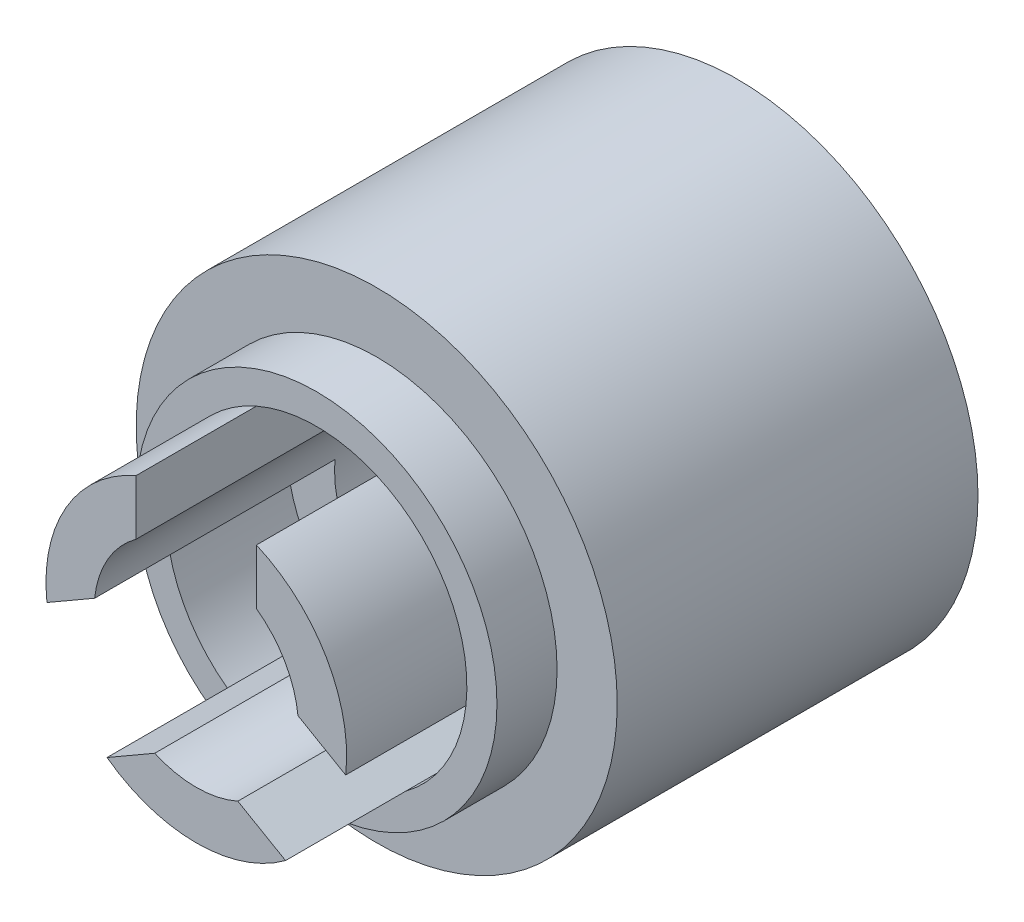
SolidWorks part; units mm, degrees
ref_plane "Front Plane" through (0, 0, 0) normal (0, 0, 1) x (1, 0, 0)
ref_plane "Top Plane" through (0, 0, 0) normal (0, 1, 0) x (1, 0, 0)
ref_plane "Right Plane" through (0, 0, 0) normal (1, 0, 0) x (0, 0, -1)
sketch "Sketch1" plane through (0, 0, 0) normal (0, 0, 1) x (1, 0, 0)
  circle A0 centre (0, 0) radius 5.08
  dimension "D1" = 10.16
extrude "Boss-Extrude1" add sketch "Sketch1" against normal blind 7.62
sketch "Sketch2" plane through (0, 0, 0) normal (0, 0, 1) x (1, 0, 0)
  line L0 (-1.27, 2.9099) -> (-1.27, 0.8424)
  line L1 (0, 0) -> (0, 4.3222) construction
  line L2 (1.27, 2.9099) -> (1.27, 0.8424)
  line L3 (3.1551, -0.3551) -> (1.3646, 0.6786)
  line L4 (1.8851, -2.5548) -> (0.0946, -1.5211)
  line L5 (-1.8851, -2.5548) -> (-0.0946, -1.5211)
  line L6 (-3.1551, -0.3551) -> (-1.3646, 0.6786)
  circle A0 centre (0, 0) radius 3.81
  arc A1 (-3.1551, -0.3551) -> (-1.8851, -2.5548) centre (0, 0) ccw
  arc A2 (1.27, 0.8424) -> (-1.27, 0.8424) centre (0, 0) ccw
  arc A3 (0.0946, -1.5211) -> (1.3646, 0.6786) centre (0, 0) ccw
  arc A4 (-1.3646, 0.6786) -> (-0.0946, -1.5211) centre (0, 0) ccw
  circle A5 centre (0, 0) radius 1.524
  arc A6 (1.27, 2.9099) -> (-1.27, 2.9099) centre (0, 0) ccw
  arc A7 (1.8851, -2.5548) -> (3.1551, -0.3551) centre (0, 0) ccw
  point P19 (0, 0)
  dimension "D1" = 7.62
  dimension "D2" = 6.35
  dimension "D3" = 3.048
  dimension "D4" = 1.27
  dimension "D5" = 1.27
  dimension "D6" = 3
extrude "Boss-Extrude2" add sketch "Sketch2" along normal blind 1.27
sketch "Sketch3" plane through (0, 0, -7.62) normal (0, 0, -1) x (-1, 0, 0)
  circle A0 centre (0, 0) radius 2.159
  dimension "D1" = 4.318
extrude "Cut-Extrude1" cut sketch "Sketch3" against normal through all
sketch "Sketch4" plane through (0, 0, -7.62) normal (0, 0, -1) x (-1, 0, 0)
  circle A0 centre (0, 0) radius 3.429
  dimension "D1" = 6.858
extrude "Cut-Extrude2" cut sketch "Sketch4" against normal blind 5.08
sketch "Sketch6" plane through (0, 0, 1.27) normal (0, 0, 1) x (1, 0, 0)
  line L0 (-1.27, 1.746) -> (-1.27, 2.9099)
  line L1 (1.27, 1.746) -> (1.27, 2.9099)
  line L2 (2.147, 0.2269) -> (3.1551, -0.3551)
  line L3 (0.877, -1.9728) -> (1.8851, -2.5548)
  line L4 (-0.877, -1.9728) -> (-1.8851, -2.5548)
  line L5 (-2.147, 0.2269) -> (-3.1551, -0.3551)
  arc A0 (-1.27, 2.9099) -> (-3.1551, -0.3551) centre (0, 0) ccw
  arc A1 (-1.27, 1.746) -> (-2.147, 0.2269) centre (0, 0) ccw
  arc A2 (-1.8851, -2.5548) -> (1.8851, -2.5548) centre (0, 0) ccw
  arc A3 (-0.877, -1.9728) -> (0.877, -1.9728) centre (0, 0) ccw
  arc A4 (2.147, 0.2269) -> (1.27, 1.746) centre (0, 0) ccw
  arc A5 (3.1551, -0.3551) -> (1.27, 2.9099) centre (0, 0) ccw
extrude "Boss-Extrude3" add sketch "Sketch6" along normal blind 2.54
sketch "Sketch7" plane through (0, 0, 0) normal (0, 0, 1) x (1, 0, 0)
  line L0 (1.27, 1.746) -> (1.27, 2.9099)
  line L1 (2.147, 0.2269) -> (3.1551, -0.3551)
  line L2 (-1.27, 1.746) -> (-1.27, 2.9099)
  line L3 (-2.147, 0.2269) -> (-3.1551, -0.3551)
  line L4 (-0.877, -1.9728) -> (-1.8851, -2.5548)
  line L5 (0.877, -1.9728) -> (1.8851, -2.5548)
  arc A0 (1.27, 2.9099) -> (-1.27, 2.9099) centre (0, 0) ccw
  arc A1 (1.27, 1.746) -> (-1.27, 1.746) centre (0, 0) ccw
  arc A2 (-2.147, 0.2269) -> (-0.877, -1.9728) centre (0, 0) ccw
  arc A3 (-3.1551, -0.3551) -> (-1.8851, -2.5548) centre (0, 0) ccw
  arc A4 (1.8851, -2.5548) -> (3.1551, -0.3551) centre (0, 0) ccw
  arc A5 (0.877, -1.9728) -> (2.147, 0.2269) centre (0, 0) ccw
extrude "Cut-Extrude5" cut sketch "Sketch7" against normal blind 1.27
